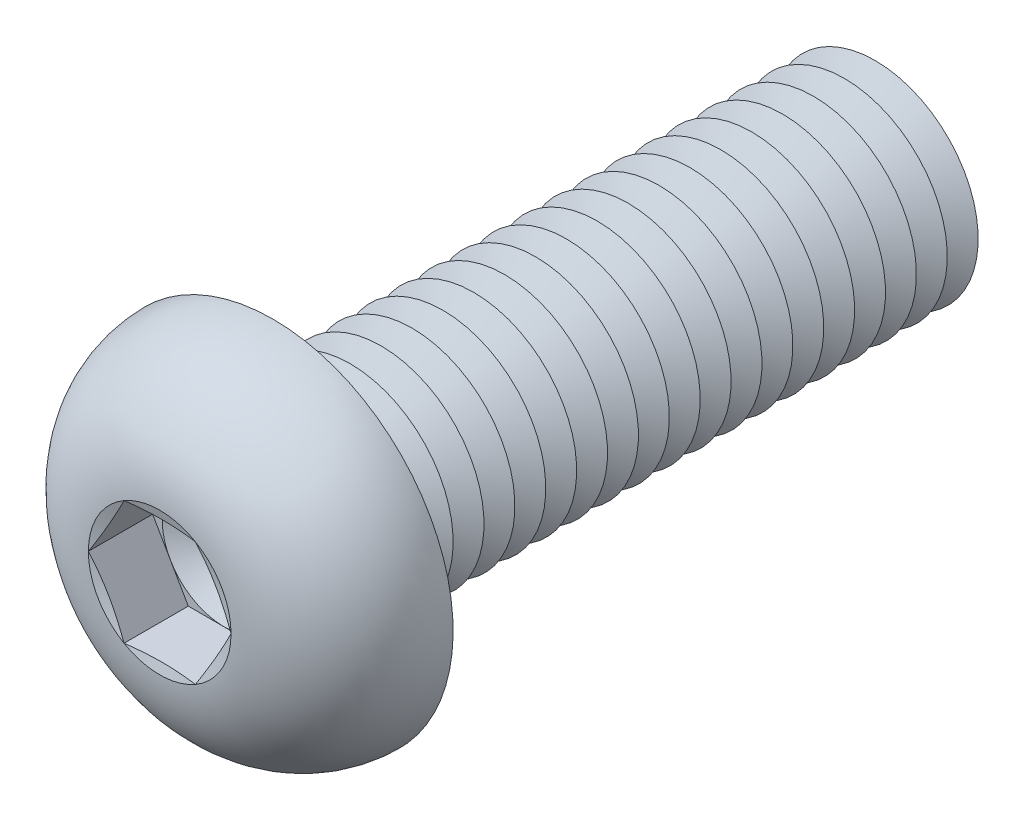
SolidWorks part; units mm, degrees
ref_plane "Front Plane" through (0, 0, 0) normal (0, 0, 1) x (1, 0, 0)
ref_plane "Top Plane" through (0, 0, 0) normal (0, 1, 0) x (1, 0, 0)
ref_plane "Right Plane" through (0, 0, 0) normal (1, 0, 0) x (0, 0, -1)
sketch "Sketch1" plane through (0, 0, 0) normal (1, 0, 0) x (0, 0, -1)
  line L0 (0, 5) -> (0, 8.75)
  line L3 (0, 5) -> (30, 5)
  line L4 (30, 5) -> (30, 0)
  line L5 (30, 0) -> (-5.5, 0) construction
  line L6 (-5.5, 0) -> (30, 0)
  line L7 (-5.5, 3.4641) -> (-5.5, 1.732) construction
  line L8 (-5.5, 1.732) -> (-5.5, 0)
  line L9 (-5.5, 3.4641) -> (-5.0359, 1.732)
  line L10 (-5.0359, 1.732) -> (-5.5, 1.732)
  line L11 (30, 0) -> (22.7481, 0) construction
  line L12 (0, 8.75) -> (-5.5, 8.75) construction
  arc A1 (0, 8.75) -> (-5.5, 3.4641) centre (0, 3.2457) ccw
  point P8 (30, 2.5)
  dimension "D1" = 17.5
  dimension "D2" = 10
  dimension "D3" = 5.5
  dimension "D4" = 6.9282
  dimension "D5" = 30
  dimension "D6" = 15
revolve "Revolve1" add sketch "Sketch1" angle 360 about L5
fillet "Fillet1" radius 0.75 1 edges at (0, 5, 0)
sketch "Sketch2" plane through (0, 0, 0) normal (1, 0, 0) x (0, 0, -1)
  line L0 (29.25, 5) -> (30.75, 5)
  line L1 (30, 5) -> (0.75, 5) construction
  line L2 (30.75, 5) -> (30, 3.701)
  line L3 (30, -5) -> (30, 5) construction
  line L4 (30, 3.701) -> (29.25, 5)
  dimension "D1" = 1.5
revolve "Cut-Revolve1" cut sketch "Sketch2" angle 360 about axis through (0, 0, -30) along (0, 0, -1)
pattern_linear "LPattern1" count 20 spacing 1.5 along (0, 0, 1) of "Cut-Revolve1"
sketch "Sketch3" plane through (0, 0, 5.5) normal (0, 0, 1) x (1, 0, 0)
  line L7 (1.732, 3) -> (-1.7321, 3)
  line L8 (-1.7321, 3) -> (-3.4641, 0)
  line L9 (-3.4641, 0) -> (-1.732, -3)
  line L10 (-1.732, -3) -> (1.732, -3)
  line L11 (1.732, -3) -> (3.4641, 0)
  line L12 (3.4641, 0) -> (1.732, 3)
  circle A0 centre (0, 0) radius 3 construction
  circle A3 centre (0, 0) radius 3.4641 construction
extrude "Cut-Extrude1" cut sketch "Sketch3" against normal blind 3.12
sketch "Sketch4" plane through (0, 0, 2.38) normal (0, 0, 1) x (1, 0, 0)
  line L1 (1.732, 3) -> (-1.7321, 3) construction
  circle A0 centre (0, 0) radius 3
extrude "Cut-Extrude2" cut sketch "Sketch4" against normal through all draft 60
